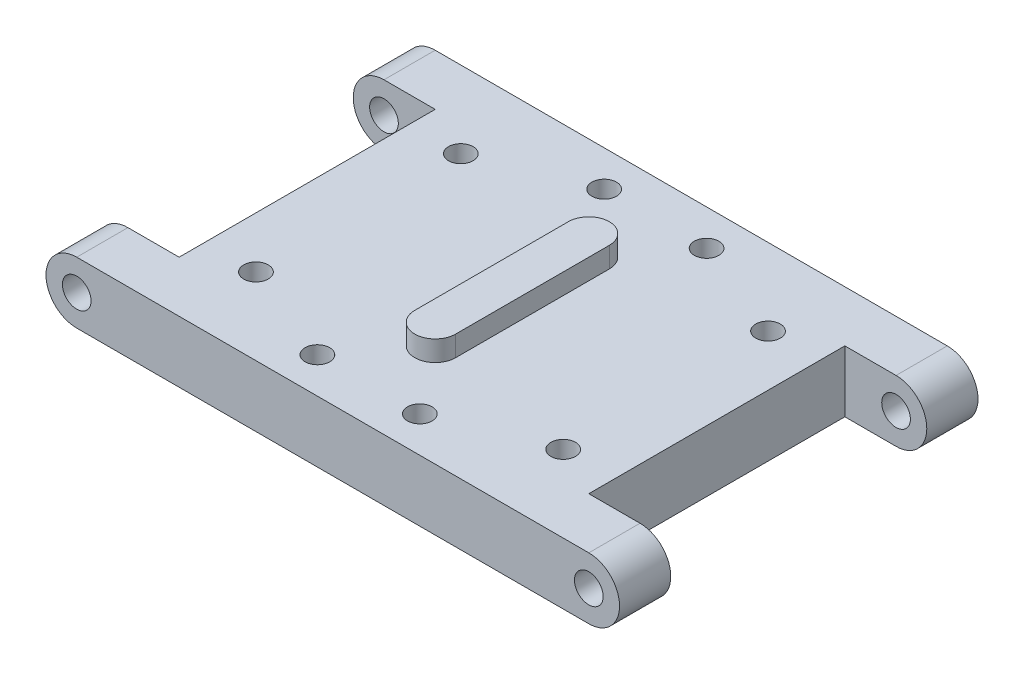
SolidWorks part; units mm, degrees
ref_plane "Front Plane" through (0, 0, 0) normal (0, 0, 1) x (1, 0, 0)
ref_plane "Top Plane" through (0, 0, 0) normal (0, 1, 0) x (1, 0, 0)
ref_plane "Right Plane" through (0, 0, 0) normal (1, 0, 0) x (0, 0, -1)
sketch "Sketch1" plane through (0, 0, 0) normal (0, 0, 1) x (1, 0, 0)
  line L0 (-31.75, 0) -> (31.75, 0) construction
  line L1 (-31.75, 3.81) -> (31.75, 3.81)
  line L2 (-31.75, -3.81) -> (31.75, -3.81)
  arc A0 (-31.75, 3.81) -> (-31.75, -3.81) centre (-31.75, 0) ccw
  arc A1 (31.75, -3.81) -> (31.75, 3.81) centre (31.75, 0) ccw
  point P2 (0, 0)
  dimension "D2" = 3.81
  dimension "D1" = 63.5
extrude "Boss-Extrude1" add sketch "Sketch1" along normal mid plane 44.45
sketch "Sketch2" plane through (0, 3.81, 0) normal (0, 1, 0) x (1, 0, 0)
  line L0 (-35.56, 22.225) -> (-35.56, -22.225) construction
  line L1 (-45.72, 15.875) -> (-25.4, 15.875)
  line L2 (-45.72, 15.875) -> (-45.72, -15.875)
  line L3 (-45.72, -15.875) -> (-25.4, -15.875)
  line L4 (-25.4, 15.875) -> (-25.4, -15.875)
  line L5 (-45.72, 15.875) -> (-25.4, -15.875) construction
  line L6 (-45.72, -15.875) -> (-25.4, 15.875) construction
  line L7 (0, 27.2462) -> (0, -28.7091) construction
  line L8 (45.72, -15.875) -> (25.4, -15.875)
  line L9 (25.4, 15.875) -> (25.4, -15.875)
  line L10 (45.72, 15.875) -> (25.4, 15.875)
  line L11 (45.72, 15.875) -> (45.72, -15.875)
  point P0 (-35.56, 0)
  dimension "D1" = 31.75
  dimension "D2" = 10.16
extrude "Cut-Extrude1" cut sketch "Sketch2" against normal through all
sketch "Sketch3" plane through (0, -3.81, 0) normal (0, -1, 0) x (1, 0, 0)
  line L0 (0, 17.78) -> (0, -17.78) construction
  line L1 (-6.35, 17.78) -> (6.35, 17.78) construction
  line L2 (-6.35, 20.32) -> (6.35, 20.32)
  line L3 (-6.35, 15.24) -> (6.35, 15.24)
  line L4 (-6.35, -17.78) -> (6.35, -17.78) construction
  line L5 (-6.35, -15.24) -> (6.35, -15.24)
  line L6 (-6.35, -20.32) -> (6.35, -20.32)
  arc A0 (-6.35, 20.32) -> (-6.35, 15.24) centre (-6.35, 17.78) ccw
  arc A1 (6.35, 15.24) -> (6.35, 20.32) centre (6.35, 17.78) ccw
  arc A2 (-6.35, -15.24) -> (-6.35, -20.32) centre (-6.35, -17.78) ccw
  arc A3 (6.35, -20.32) -> (6.35, -15.24) centre (6.35, -17.78) ccw
  point P4 (0, 0)
  point P7 (0, 17.78)
  point P14 (0, -17.78)
  dimension "D3" = 2.54
  dimension "D4" = 2.54
  dimension "D1" = 35.56
  dimension "D2" = 12.7
  dimension "D5" = 12.7
extrude "Cut-Extrude2" cut sketch "Sketch3" against normal blind 2.54
sketch "Sketch4" plane through (0, -1.27, 0) normal (0, -1, 0) x (1, 0, 0)
  line L0 (-9.143, 0) -> (9.2162, 0) construction
  circle A0 centre (-6.35, 17.78) radius 1.524
  circle A1 centre (6.35, 17.78) radius 1.524
  circle A2 centre (6.35, -17.78) radius 1.524
  circle A3 centre (-6.35, -17.78) radius 1.524
  dimension "D1" = 3.048
extrude "Cut-Extrude3" cut sketch "Sketch4" against normal through all
sketch "Sketch5" plane through (0, 0, 22.225) normal (0, 0, 1) x (1, 0, 0)
  circle A0 centre (-31.75, 0) radius 1.778
  circle A1 centre (31.75, 0) radius 1.778
  dimension "D1" = 3.556
extrude "Cut-Extrude4" cut sketch "Sketch5" against normal through all
sketch "Sketch6" plane through (0, 3.81, 0) normal (0, 1, 0) x (1, 0, 0)
  line L0 (0, 9.525) -> (0, -9.525) construction
  line L1 (2.54, 9.525) -> (2.54, -9.525)
  line L2 (-2.54, 9.525) -> (-2.54, -9.525)
  arc A0 (2.54, 9.525) -> (-2.54, 9.525) centre (0, 9.525) ccw
  arc A1 (-2.54, -9.525) -> (2.54, -9.525) centre (0, -9.525) ccw
  point P2 (0, 0)
  dimension "D2" = 2.54
  dimension "D1" = 19.05
extrude "Boss-Extrude2" add sketch "Sketch6" along normal blind 2.54
sketch "Sketch7" plane through (0, -3.81, 0) normal (0, -1, 0) x (1, 0, 0)
  line L1 (-19.05, -27.0267) -> (19.05, -27.0267) construction
  line L2 (-19.05, -27.0267) -> (-19.05, 27.0267) construction
  line L3 (-19.05, 27.0267) -> (19.05, 27.0267) construction
  line L4 (19.05, -27.0267) -> (19.05, 27.0267) construction
  line L5 (-19.05, -27.0267) -> (19.05, 27.0267) construction
  line L6 (-19.05, 27.0267) -> (19.05, -27.0267) construction
  line L8 (0, -27.0267) -> (0, 27.0267) construction
  line L9 (-19.05, 0) -> (19.05, 0) construction
  circle A0 centre (19.05, -12.7) radius 1.524
  circle A1 centre (19.05, 12.7) radius 1.524
  circle A2 centre (-19.05, 12.7) radius 1.524
  circle A3 centre (-19.05, -12.7) radius 1.524
  point P0 (0, 0)
  point P6 (19.05, 0)
  dimension "D2" = 3.048
  dimension "D3" = 3.048
  dimension "D5" = 25.4
  dimension "D4" = 12.7
  dimension "D1" = 19.05
extrude "Cut-Extrude5" cut sketch "Sketch7" against normal through all
